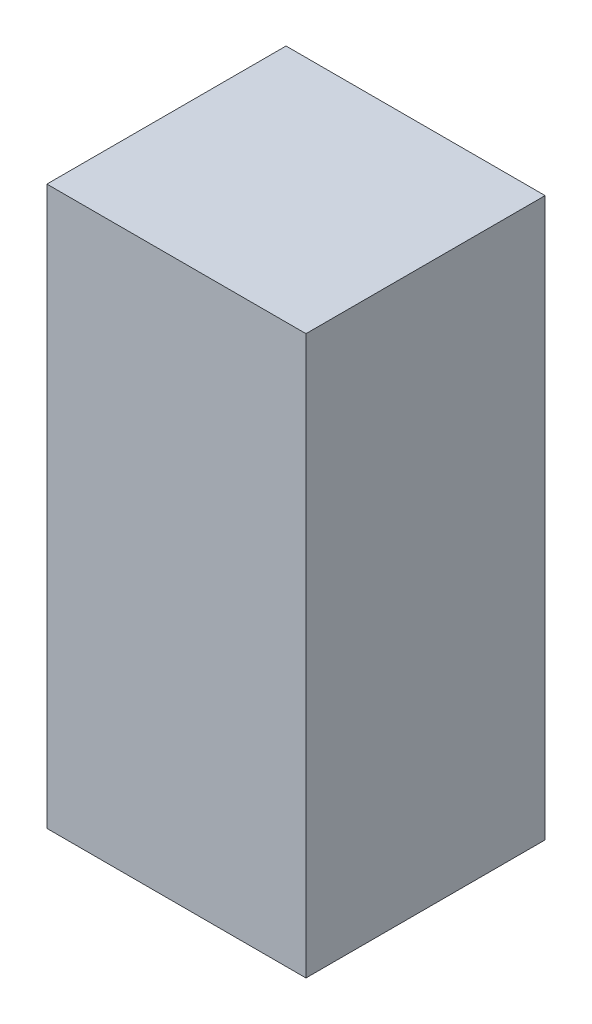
SolidWorks part; units mm, degrees
ref_plane "Plan de face" through (0, 0, 0) normal (0, 0, 1) x (1, 0, 0)
ref_plane "Plan de dessus" through (0, 0, 0) normal (0, 1, 0) x (1, 0, 0)
ref_plane "Plan de droite" through (0, 0, 0) normal (1, 0, 0) x (0, 0, -1)
sketch "Esquisse1" plane through (0, 0, 0) normal (0, 0, 1) x (1, 0, 0)
  line L0 (8.7, 29.364) -> (8.7, 9.364) construction
  line L2 (8.7, 20.864) -> (15.2, 20.864)
  line L3 (8.7, 20.864) -> (8.7, 6.864)
  line L4 (8.7, 6.864) -> (15.2, 6.864)
  line L5 (15.2, 20.864) -> (15.2, 6.864)
  line L6 (15.2, 29.364) -> (15.2, 13.864) construction
  line L7 (7.7, -2.636) -> (3.5, -2.636) construction
  dimension "D1" = 14
  dimension "D2" = 9.5
extrude "Extrusion1" add sketch "Esquisse1" against normal up to surface (2.7548 mm away) and the other way up to surface (3.2452 mm away)
